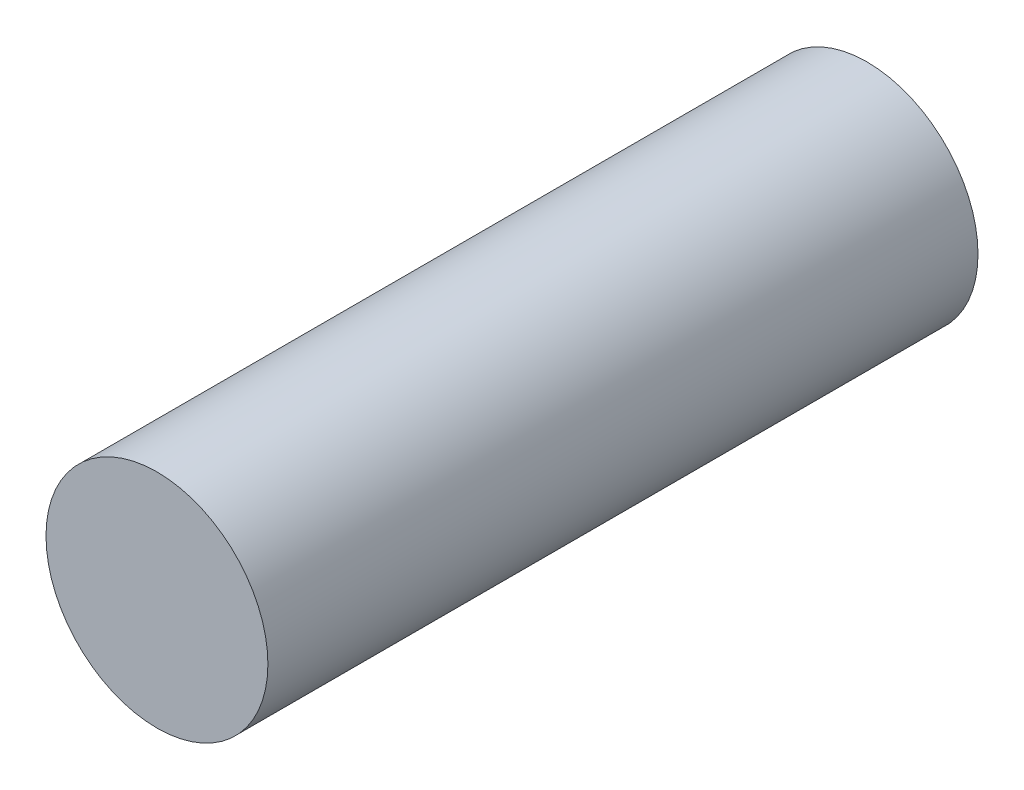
SolidWorks part; units mm, degrees
ref_plane "Front Plane" through (0, 0, 0) normal (0, 0, 1) x (1, 0, 0)
ref_plane "Top Plane" through (0, 0, 0) normal (0, 1, 0) x (1, 0, 0)
ref_plane "Right Plane" through (0, 0, 0) normal (1, 0, 0) x (0, 0, -1)
sketch "Sketch1" plane through (0, 0, 0) normal (0, 0, 1) x (1, 0, 0)
  circle A0 centre (0, 0) radius 3.175
extrude "Boss-Extrude1" add sketch "Sketch1" along normal blind 20.32
